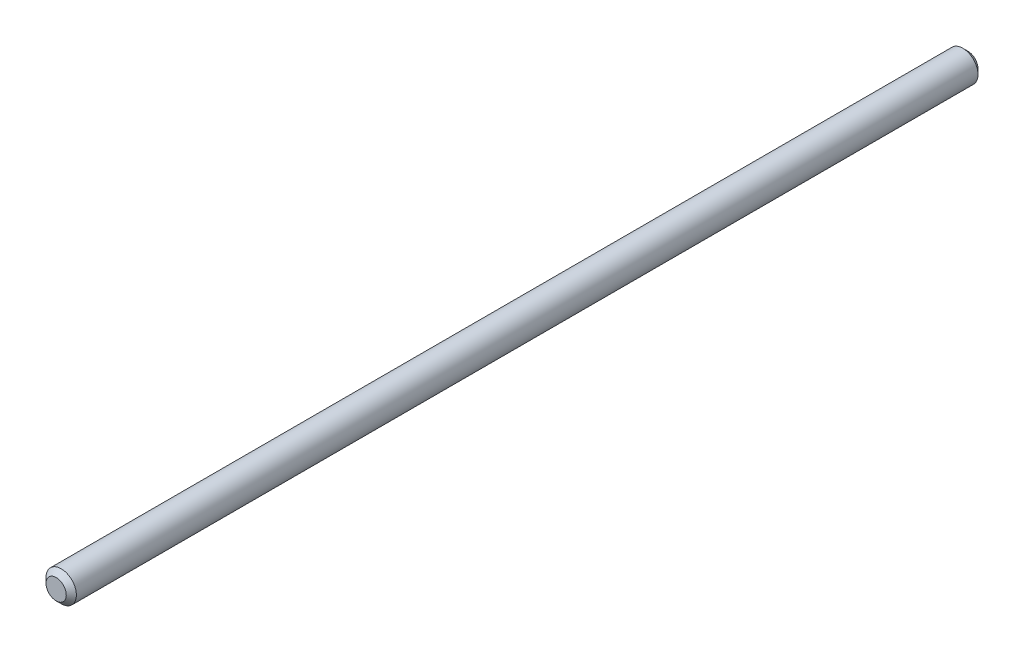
SolidWorks part; units mm, degrees
ref_plane "Plan1" through (0, 0, 0) normal (0, 0, 1) x (1, 0, 0)
ref_plane "Plan2" through (0, 0, 0) normal (0, 1, 0) x (1, 0, 0)
ref_plane "Plan3" through (0, 0, 0) normal (1, 0, 0) x (0, 0, -1)
sketch "Esquisse1" plane through (0, 0, 0) normal (0, 0, 1) x (1, 0, 0)
  circle A0 centre (0, 0) radius 1.5
  dimension "D1" = 3
extrude "Base-Extrusion" add sketch "Esquisse1" along normal blind 90
chamfer "Chanfrein1" distance 0.5 angle 45 2 edges at (1.5, 0, 0) (1.5, 0, 90)
